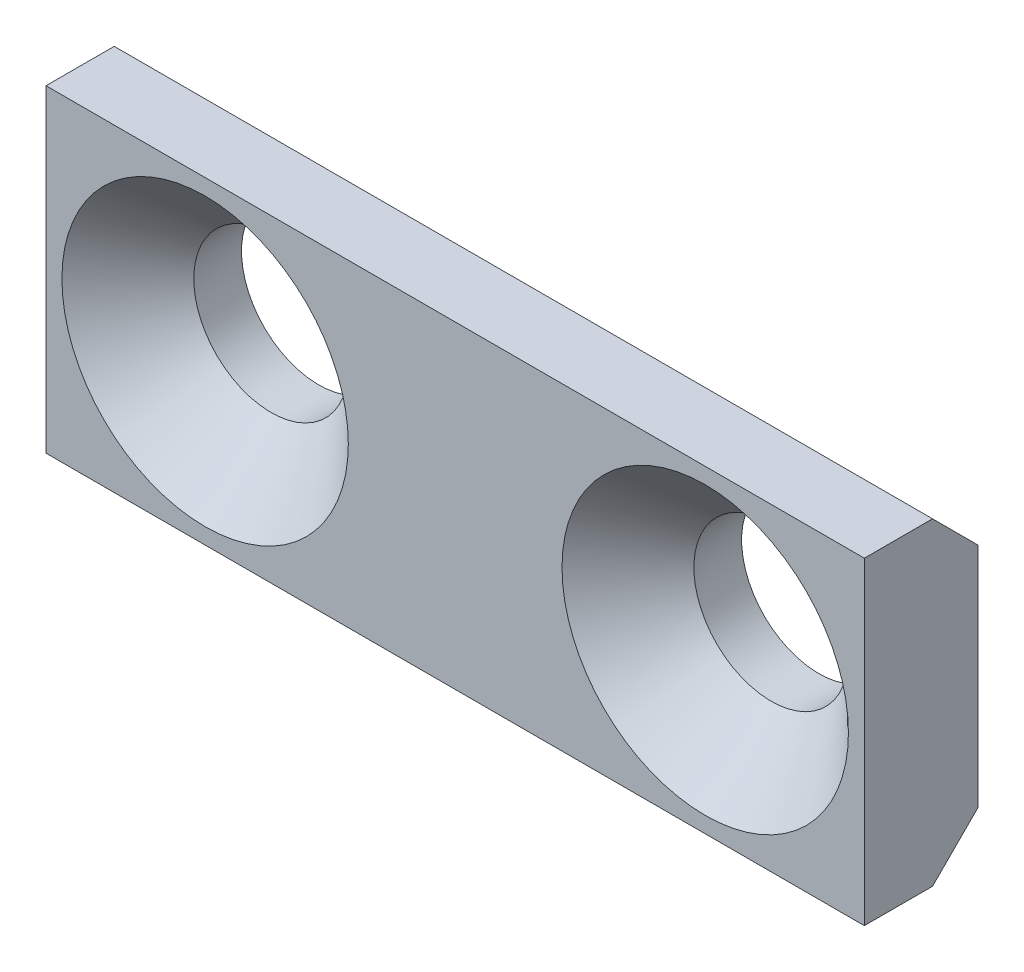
SolidWorks part; units mm, degrees
ref_plane "Face" through (0, 0, 0) normal (0, 0, 1) x (1, 0, 0)
ref_plane "Dessus" through (0, 0, 0) normal (0, 1, 0) x (1, 0, 0)
ref_plane "Droite" through (0, 0, 0) normal (1, 0, 0) x (0, 0, -1)
sketch "Esquisse1" plane through (0, 0, 0) normal (0, 0, 1) x (1, 0, 0)
  line L0 (-15.4175, 0) -> (21.356, 0) construction
  line L2 (-9, 3.5) -> (9, 3.5)
  line L3 (-9, 3.5) -> (-9, -3.5)
  line L4 (-9, -3.5) -> (9, -3.5)
  line L5 (9, 3.5) -> (9, -3.5)
  dimension "D1" = 7
  dimension "D2" = 3.5
  dimension "D3" = 18
  dimension "D4" = 9
extrude "Extrusion1" add sketch "Esquisse1" along normal blind 2.5
hole_wizard "Fraisage pour vis à tête fraisée à fond plat M31" positions "Esquisse3" profile "Esquisse2" countersink size "M3" standard "ISO"
sketch "Esquisse3" plane through (0, 0, 2.5) normal (0, 0, 1) x (1, 0, 0)
  circle A0 centre (5.5, 0) radius 1.2 construction
  circle A1 centre (-5.5, 0) radius 1.2 construction
  point P0 (-5.5, 0)
  point P1 (5.5, 0)
sketch "Esquisse2" plane through (-5.5, 0, 2.5) normal (1, 0, 0) x (0, -1, 0)
  line L0 (0, 0) -> (0, 2.5)
  line L1 (0, 2.5) -> (1.7, 2.5)
  line L2 (1.7, 2.5) -> (1.7, 1.45)
  line L3 (1.7, 1.45) -> (3.15, 0)
  line L5 (3.15, 0) -> (0, 0)
  line L6 (-1.7, 1.45) -> (-3.15, 0) construction
  line L11 (0, -6.35) -> (0, 107.95) construction
  dimension "Diamètre du perçage jusqu'au prochain" = 3.4
  dimension "Profondeur du perçage jusqu'au prochain" = 2.5
  dimension "Diamètre du fraisage entrant" = 6.3
  dimension "Angle du fraisage entrant" = 90
chamfer "Chanfrein1" distance 1 angle 45
